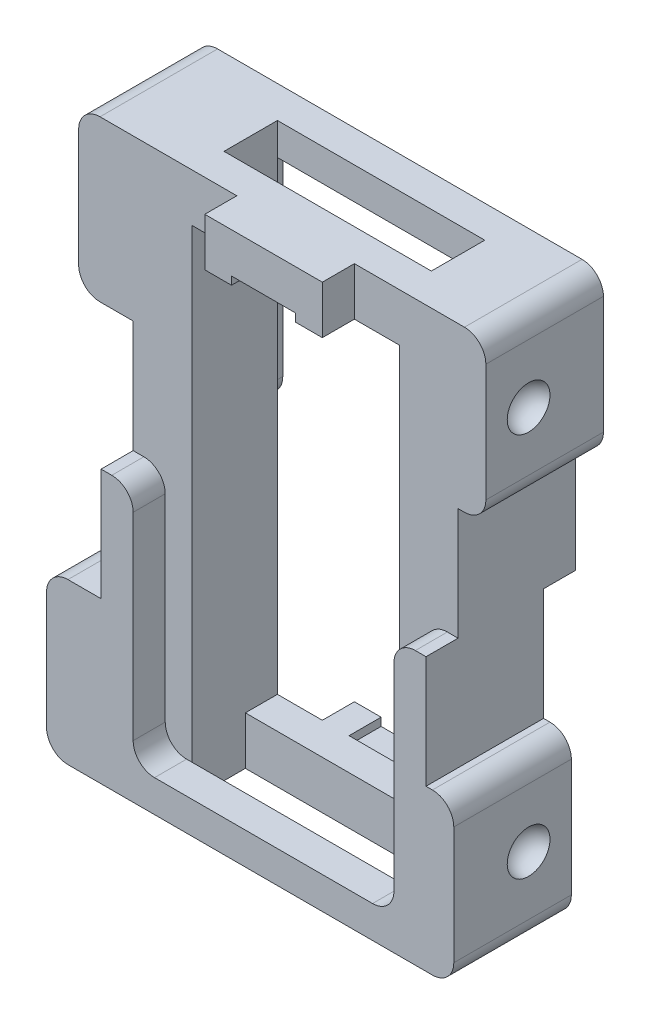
SolidWorks part; units mm, degrees
ref_plane "Front Plane" through (0, 0, 0) normal (0, 0, 1) x (1, 0, 0)
ref_plane "Top Plane" through (0, 0, 0) normal (0, 1, 0) x (1, 0, 0)
ref_plane "Right Plane" through (0, 0, 0) normal (1, 0, 0) x (0, 0, -1)
sketch "Body" plane through (0, 0, 0) normal (0, 0, 1) x (1, 0, 0)
  line L0 (0, 22.5) -> (0, -22.5) construction
  line L1 (-12.2, -22.5) -> (12.2, -22.5) construction
  line L2 (-12.2, -22.5) -> (-12.2, 22.5) construction
  line L3 (-12.2, 22.5) -> (12.2, 22.5) construction
  line L4 (12.2, -22.5) -> (12.2, 22.5) construction
  line L5 (-12.2, 0) -> (12.2, 0) construction
  line L6 (0, 22.5) -> (0, 25.5) construction
  line L7 (-9.7, 21) -> (9.7, 21)
  line L8 (-9.7, 21) -> (-9.7, -21)
  line L9 (-9.7, -21) -> (9.7, -21)
  line L10 (9.7, 21) -> (9.7, -21)
  line L11 (-15.2, 25.5) -> (15.2, 25.5)
  line L12 (-15.2, 25.5) -> (-15.2, -25.5)
  line L13 (-15.2, -25.5) -> (15.2, -25.5)
  line L14 (15.2, 25.5) -> (15.2, -25.5)
  line L15 (-12.2, 0) -> (-15.2, 0) construction
  circle A0 centre (0, 12.5) radius 8.5 construction
  dimension "D3" = 10
  dimension "D4" = 17
  dimension "DynWidth" = 24.4
  dimension "DynHeight" = 45
  dimension "D5" = 2.5
  dimension "D6" = 3
extrude "Main Body" add sketch "Body" along normal mid plane 8
sketch "Sketch2" plane through (0, 0, 4) normal (0, 0, 1) x (1, 0, 0)
  line L0 (-15.2, 0) -> (15.2, 0) construction
  line L1 (-15.2, 25.5) -> (-15.2, -25.5) construction
  line L2 (15.2, -25.5) -> (15.2, 25.5) construction
  line L3 (0, 25.5) -> (0, -25.5) construction
  line L4 (15.2, 25.5) -> (-15.2, 25.5) construction
  line L5 (-15.2, -25.5) -> (15.2, -25.5) construction
  line L6 (-12.2, 0) -> (-15.2, 0)
  line L7 (-15.2, 0) -> (-15.2, -25.5)
  line L8 (-12.2, 0) -> (-12.2, -22.5)
  line L9 (-12.2, -22.5) -> (12.2, -22.5)
  line L10 (12.2, 0) -> (12.2, -22.5)
  line L11 (-15.2, -25.5) -> (15.2, -25.5)
  line L12 (15.2, -25.5) -> (15.2, 0)
  line L13 (15.2, 0) -> (12.2, 0)
  line L14 (-15.2, 22.5) -> (15.2, 22.5) construction
  line L15 (-5.5, 25.5) -> (5.5, 25.5)
  line L16 (-5.5, 25.5) -> (-5.5, 21)
  line L17 (9.7, 21) -> (-9.7, 21) construction
  line L18 (-5.5, 21) -> (-3, 21)
  line L19 (-3, 21) -> (-3, 21.75)
  line L20 (-3, 21.75) -> (3, 21.75)
  line L21 (3, 21.75) -> (3, 21)
  line L22 (3, 21) -> (5.5, 21)
  line L23 (5.5, 21) -> (5.5, 25.5)
  circle A0 centre (0, 12.5) radius 8.5 construction
  dimension "D4" = 17
  dimension "D5" = 10
  dimension "D1" = 22.5
  dimension "D2" = 24.4
  dimension "D3" = 11
  dimension "D6" = 6
  dimension "D7" = 21.75
extrude "Clamp Walls 1" add sketch "Sketch2" along normal blind 3 and the other way up to surface (8 mm away)
sketch "Sketch3" plane through (0, 0, -4) normal (0, 0, -1) x (-1, 0, 0)
  line L0 (0, -25.5) -> (0, 25.5) construction
  line L1 (15.2, -25.5) -> (-15.2, -25.5) construction
  line L2 (-15.2, 25.5) -> (15.2, 25.5) construction
  line L3 (15.2, 0) -> (-15.2, 0) construction
  line L4 (15.2, 25.5) -> (15.2, -25.5) construction
  line L5 (-15.2, -25.5) -> (-15.2, 25.5) construction
  line L6 (15.2, 0) -> (15.2, 25.5)
  line L7 (15.2, 25.5) -> (-15.2, 25.5)
  line L8 (-15.2, 25.5) -> (-15.2, 0)
  line L9 (-15.2, 0) -> (-12.2, 0)
  line L10 (-12.2, 0) -> (-12.2, 22.5)
  line L11 (-12.2, 22.5) -> (12.2, 22.5)
  line L12 (12.2, 22.5) -> (12.2, 0)
  line L13 (12.2, 0) -> (15.2, 0)
  line L14 (5.5, -25.5) -> (5.5, -21)
  line L15 (9.7, -21) -> (-9.7, -21) construction
  line L16 (5.5, -21) -> (3, -21)
  line L17 (3, -21) -> (3, -21.75)
  line L18 (3, -21.75) -> (-3, -21.75)
  line L19 (-3, -21.75) -> (-3, -21)
  line L20 (-3, -21) -> (-5.5, -21)
  line L21 (-5.5, -21) -> (-5.5, -25.5)
  line L22 (-5.5, -25.5) -> (5.5, -25.5)
  dimension "D1" = 24.4
  dimension "D2" = 22.5
  dimension "D3" = 11
  dimension "D4" = 6
  dimension "D5" = 21.75
extrude "Clamp Walls 2" add sketch "Sketch3" along normal blind 3
sketch "Sketch7" plane through (-15.2, 0, 0) normal (-1, 0, 0) x (0, 0, 1)
  line L0 (-4, 0) -> (-4, -25.5) construction
  line L1 (7, -25.5) -> (-4, -25.5)
  line L2 (7, -25.5) -> (7, -10.5)
  line L3 (7, -10.5) -> (-4, -10.5)
  line L4 (-4, -25.5) -> (-4, -10.5)
  line L6 (4, 25.5) -> (4, 0) construction
  line L7 (-7, 25.5) -> (4, 25.5)
  line L8 (-7, 25.5) -> (-7, 10.5)
  line L9 (-7, 10.5) -> (4, 10.5)
  line L10 (7, 0) -> (-7, 0) construction
  line L11 (4, 25.5) -> (4, 10.5)
  dimension "D1" = 15
extrude "Standoff 1" add sketch "Sketch7" along normal blind 5.1
sketch "Sketch8" plane through (15.2, 0, 0) normal (1, 0, 0) x (0, 0, -1)
  line L0 (-7, -25.5) -> (-7, 0) construction
  line L1 (4, -25.5) -> (-7, -25.5)
  line L2 (4, -25.5) -> (4, -10.5)
  line L3 (4, -10.5) -> (-7, -10.5)
  line L4 (-7, -25.5) -> (-7, -10.5)
  line L5 (-4, 0) -> (-4, 25.5) construction
  line L6 (7, 25.5) -> (-4, 25.5)
  line L7 (7, 25.5) -> (7, 10.5)
  line L8 (7, 10.5) -> (-4, 10.5)
  line L9 (-4, 25.5) -> (-4, 10.5)
  line L10 (7, 25.5) -> (7, 10.5) construction
extrude "Standoff 2" add sketch "Sketch8" along normal blind 2.6
sketch "Sketch9" plane through (17.8, 0, 0) normal (1, 0, 0) x (0, 0, -1)
  line L0 (0, 0) -> (0, -10.5) construction
  line L1 (0, -20) -> (0, -16)
  line L2 (4, -10.5) -> (-7, -10.5) construction
  line L3 (0, 20) -> (0, 16)
  line L5 (0, -10.5) -> (0, -25.5) construction
  line L6 (-7, -25.5) -> (4, -25.5) construction
  line L7 (0, 0) -> (14.6773, 0) construction
  arc A0 (0, -20) -> (0, -16) centre (0, -18) ccw
  arc A1 (0, 20) -> (0, 16) centre (0, 18) cw
  dimension "D1" = 4
revolve "Mounting 1" cut sketch "Sketch9" angle 360 about L5
fillet "Contouring" radius 2 16 edges at (-20.3, -10.5, 1.5) (-20.3, 10.5, -1.5) (17.8, 10.5, -1.5) (17.8, -10.5, 1.5) (-12.2, 0, 5.5) (12.2, 0, 5.5) (12.2, 0, -5.5) (-12.2, 0, -5.5) (12.2, 22.5, -5.5) (-12.2, 22.5, -5.5) (-12.2, -22.5, 5.5) (12.2, -22.5, 5.5) (-20.3, -25.5, 1.5) (-20.3, 25.5, -1.5) (17.8, 25.5, -1.5) (17.8, -25.5, 1.5)
sketch "Sketch11" plane through (0, 25.5, 0) normal (0, 1, 0) x (1, 0, 0)
  line L0 (15.8, 1.5) -> (-20.3, 1.5) construction
  line L4 (-9.7, -4) -> (-9.7, 4) construction
  line L5 (9.7, -4) -> (9.7, 4) construction
  line L6 (15.8, -4) -> (15.8, 7) construction
  line L7 (-9.7, -1) -> (-9.7, 4)
  line L8 (9.7, -1) -> (9.7, 4)
  line L9 (-20.3, -4) -> (-20.3, 7) construction
  line L14 (15.8, -4) -> (5.5, -4) construction
  line L15 (9.7, -1) -> (-9.7, -1)
  line L17 (9.7, 4) -> (-9.7, 4)
  dimension "D1" = 3
extrude "Ventilation 1" cut sketch "Sketch11" against normal up to surface (4.5 mm away)
sketch "Sketch12" plane through (0, -25.5, 0) normal (0, -1, 0) x (1, 0, 0)
  line L0 (-16.4, 1.5) -> (15.8, 1.5) construction
  line L2 (15.8, -4) -> (15.8, 7) construction
  line L7 (-9.7, 4) -> (9.7, 4)
  line L8 (-9.7, 4) -> (-9.7, -1)
  line L9 (-9.7, -1) -> (9.7, -1)
  line L10 (9.7, 4) -> (9.7, -1)
  line L11 (-9.7, -4) -> (-9.7, 1) construction
  line L12 (-9.7, 1) -> (9.7, 1) construction
extrude "Ventilation 2" cut sketch "Sketch12" against normal up to surface (4.5 mm away)
ref_point "Ref Center"
equation "\"D6@Body\"=\"width keep@values@params.sldprt\""
equation "\"D1@Sketch2\"=\"DynHeight@Body\"/2"
equation "\"D2@Sketch2\"=\"DynWidth@Body\""
equation "\"D7@Sketch2\"=\"DynHeight@Body\"/2-0.75"
equation "\"D1@Sketch3\"=\"DynWidth@Body\""
equation "\"D2@Sketch3\"=\"DynHeight@Body\"/2"
equation "\"D5@Sketch3\"=\"DynHeight@Body\"/2-0.75"
equation "\"D1@Clamp Walls 1\" = \"width keep@values@params.sldprt\""
equation "\"D1@Clamp Walls 2\"=\"width keep@values@params.sldprt\""
equation "\"D1@Standoff 2\"=5.6-\"width keep@values@params.sldprt\""
equation "\"D1@Sketch11\"=\"width keep@values@params.sldprt\""
equation "\"D1@Standoff 1\"=5.6+2.5-\"width keep@values@params.sldprt\""
